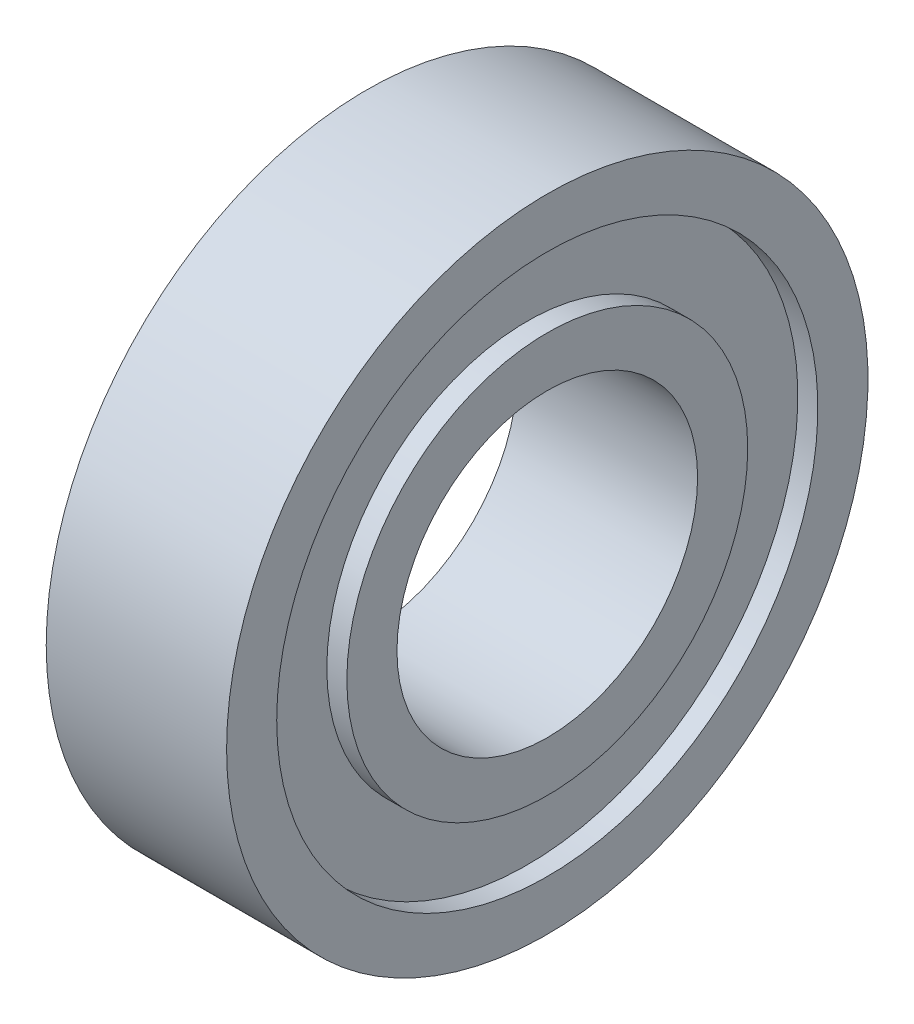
SolidWorks part; units mm, degrees
ref_plane "Plan de face" through (0, 0, 0) normal (0, 0, 1) x (1, 0, 0)
ref_plane "Plan de dessus" through (0, 0, 0) normal (0, 1, 0) x (1, 0, 0)
ref_plane "Plan de droite" through (0, 0, 0) normal (1, 0, 0) x (0, 0, -1)
sketch "Esquisse1" plane through (0, 0, 0) normal (0, 0, 1) x (1, 0, 0)
  line L0 (0, 7.5) -> (9, 7.5)
  line L1 (9, 7.5) -> (9, 10)
  line L2 (9, 10) -> (8, 10)
  line L3 (8, 10) -> (8, 13.5)
  line L4 (8, 13.5) -> (9, 13.5)
  line L5 (9, 13.5) -> (9, 16)
  line L6 (9, 16) -> (0, 16)
  line L7 (0, 16) -> (0, 13.5)
  line L8 (0, 13.5) -> (1, 13.5)
  line L9 (1, 13.5) -> (1, 10)
  line L10 (1, 10) -> (0, 10)
  line L11 (0, 10) -> (0, 7.5)
  line L12 (0, 0) -> (23.7577, 0) construction
  dimension "D1" = 32
  dimension "D2" = 15
  dimension "D3" = 27
  dimension "D4" = 20
  dimension "D5" = 9
  dimension "D6" = 1
  dimension "D7" = 1
revolve "Révolution1" add sketch "Esquisse1" angle 360 about L12
